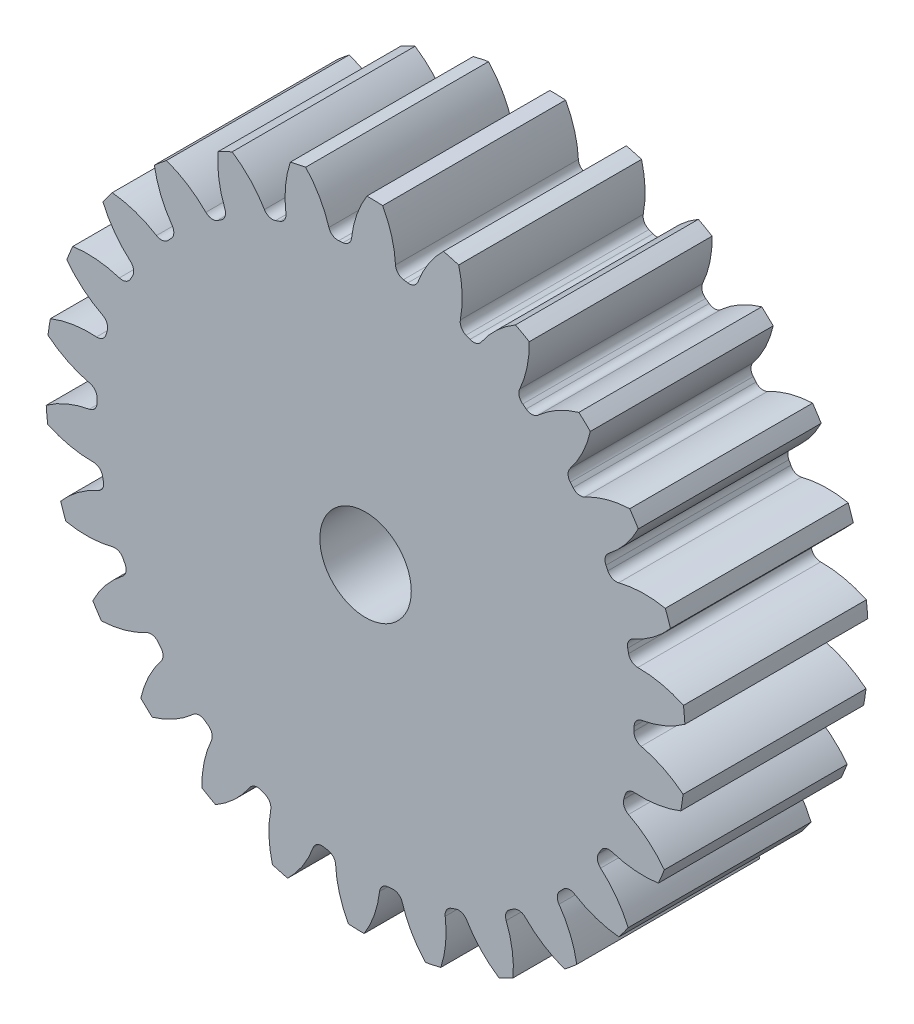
SolidWorks part; units mm, degrees
ref_plane "Front" through (0, 0, 0) normal (0, 0, 1) x (1, 0, 0)
ref_plane "Top" through (0, 0, 0) normal (0, 1, 0) x (1, 0, 0)
ref_plane "Right" through (0, 0, 0) normal (1, 0, 0) x (0, 0, -1)
sketch "Sketch3" plane through (0, 0, 0) normal (0, 0, 1) x (1, 0, 0)
  circle A0 centre (0, 0) radius 177.8
  dimension "od" = 355.6
extrude "gearBody" add sketch "Sketch3" along normal blind 101.6
sketch "Sketch2" plane through (0, 0, 0) normal (0, 0, 1) x (1, 0, 0)
  line L0 (0, 0) -> (143.3337, 59.3708) construction
  line L1 (176.7943, -22.5097) -> (0, 0) construction
  line L2 (0, 0) -> (36.3143, 0) construction
  line L3 (165.0191, 5.1675) -> (164.4443, -14.6997) construction
  line L5 (164.7317, -4.7661) -> (0, 0) construction
  line L7 (0, 0) -> (155.1433, 0) construction
  arc A0 (155.1277, 2.1943) -> (154.7414, -11.1595) centre (0, 0) ccw construction
  arc A1 (177.3974, 11.9586) -> (176.4092, -22.1951) centre (0, 0) ccw construction
  arc A2 (165.0191, 5.1675) -> (164.4443, -14.6997) centre (0, 0) ccw construction
  arc A3 (149.1227, -5.5242) -> (149.1927, -3.1068) centre (0, 0) ccw
  arc A4 (176.7943, -22.5097) -> (153.0984, -10.7457) centre (139.6613, -67.5585) ccw
  arc A5 (176.7943, -22.5097) -> (177.8, 12.2504) centre (0, 0) ccw
  arc A6 (177.8, 12.2504) -> (153.4636, 1.8761) centre (143.3337, 59.3708) cw
  arc A7 (149.1927, -3.1068) -> (153.4636, 1.8761) centre (154.3604, -3.2144) cw
  arc A8 (153.0984, -10.7457) -> (149.1227, -5.5242) centre (154.2881, -5.7156) cw
  point P6 (177.8, 12.2504)
  point P22 (176.7943, -22.5097)
  dimension "baseDia" = 310.2865
  dimension "od" = 355.6
  dimension "pd" = 330.2
  dimension "rd" = 298.45
  dimension "rFillet" = 5.1689
  dimension "pointX" = 177.8
  dimension "pointY" = 12.2504
  dimension "CTT" = 19.8672
  dimension "flankCenterAngle" = 22.5
extrude "toothCut" cut sketch "Sketch2" along normal through all
pattern_circular "CirPattern1" count 26 over 360 about axis through (0, 0, 0) along (0, 0, 1) of "toothCut"
sketch "hub1Dia" plane through (0, 0, 0) normal (0, 0, -1) x (-1, 0, 0)
  circle A0 centre (0, 0) radius 12.7
  dimension "hub1Dia" = 25.4
sketch "hub2Dia" plane through (0, 0, 101.6) normal (0, 0, 1) x (1, 0, 0)
  circle A0 centre (0, 0) radius 12.7
  dimension "hub2dia" = 25.4
sketch "boreDia" plane through (0, 0, 0) normal (0, 0, 1) x (1, 0, 0)
  circle A0 centre (0, 0) radius 25.4
  dimension "boreDia" = 50.8
extrude "bore" cut sketch "boreDia" against normal mid plane 25400
